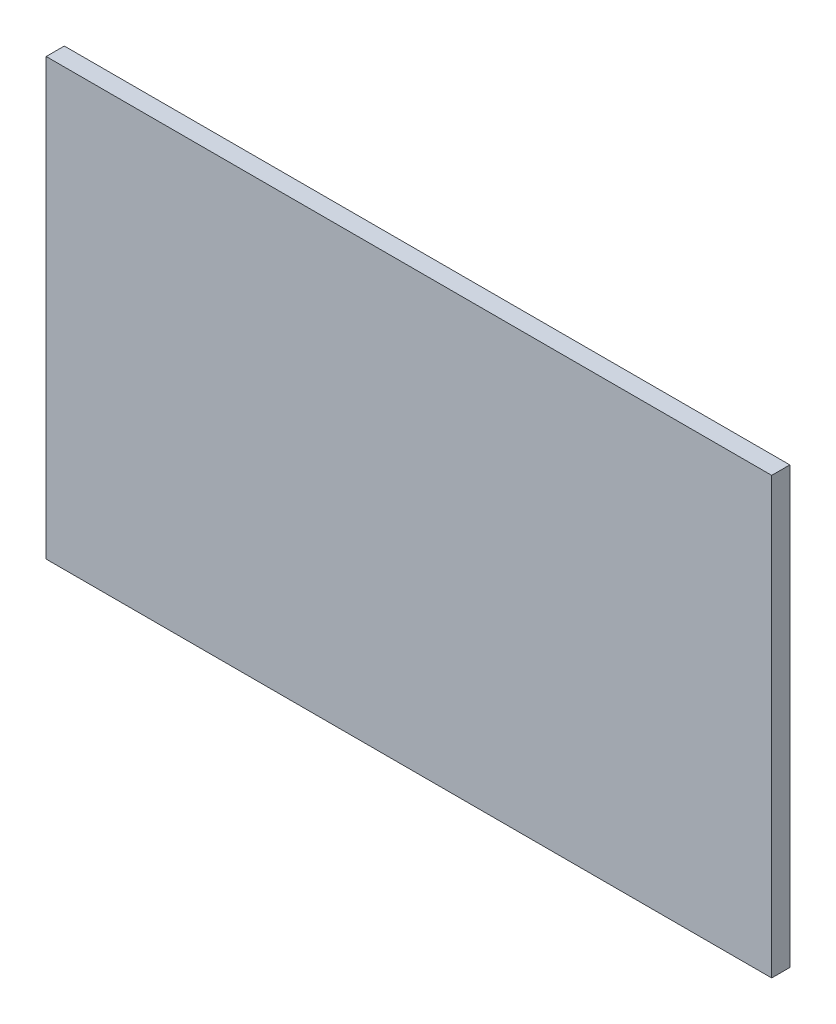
SolidWorks part; units mm, degrees
ref_plane "Front Plane" through (0, 0, 0) normal (0, 0, 1) x (1, 0, 0)
ref_plane "Top Plane" through (0, 0, 0) normal (0, 1, 0) x (1, 0, 0)
ref_plane "Right Plane" through (0, 0, 0) normal (1, 0, 0) x (0, 0, -1)
sketch "Sketch1" plane through (0, 0, 0) normal (0, 0, 1) x (1, 0, 0)
  line L1 (-127, -76.2) -> (127, -76.2)
  line L2 (-127, -76.2) -> (-127, 76.2)
  line L3 (-127, 76.2) -> (127, 76.2)
  line L4 (127, -76.2) -> (127, 76.2)
  line L5 (-127, -76.2) -> (127, 76.2) construction
  line L6 (-127, 76.2) -> (127, -76.2) construction
  point P0 (0, 0)
  dimension "D1" = 152.4
  dimension "D2" = 254
extrude "Boss-Extrude1" add sketch "Sketch1" along normal blind 6.35
